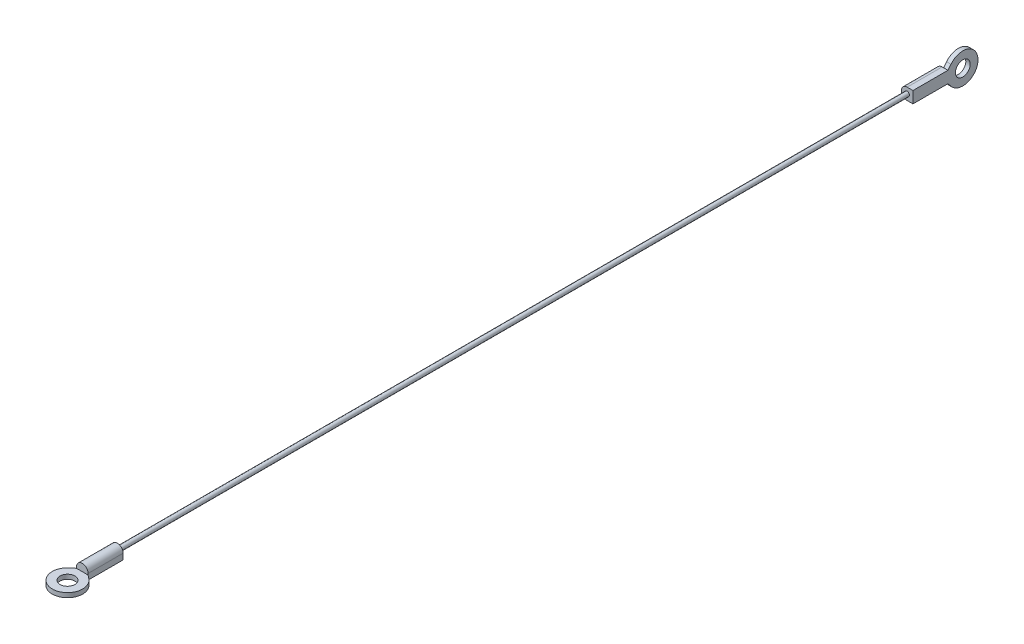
SolidWorks part; units mm, degrees
ref_plane "Front Plane" through (0, 0, 0) normal (0, 0, 1) x (1, 0, 0)
ref_plane "Top Plane" through (0, 0, 0) normal (0, 1, 0) x (1, 0, 0)
ref_plane "Right Plane" through (0, 0, 0) normal (1, 0, 0) x (0, 0, -1)
sketch "Sketch1" plane through (0, 0, 0) normal (0, 0, 1) x (1, 0, 0)
  circle A0 centre (0, 0) radius 0.795
extrude "Boss-Extrude1" add sketch "Sketch1" along normal mid plane 270.64
sketch "Sketch2" plane through (0, 0, 135.32) normal (0, 0, 1) x (1, 0, 0)
  line L0 (-1.99, 0) -> (-1.99, -1.99)
  line L1 (-1.99, -1.99) -> (0, -1.99)
  line L2 (0, -1.99) -> (1.99, -1.99)
  line L3 (1.99, -1.99) -> (1.99, 0)
  arc A0 (1.99, 0) -> (-1.99, 0) centre (0, 0) ccw
  dimension "D1" = 3.98
extrude "Boss-Extrude2" add sketch "Sketch2" along normal blind 12
sketch "Sketch3" plane through (0, -1.99, 0) normal (0, -1, 0) x (1, 0, 0)
  line L0 (1.99, 147.32) -> (3.2639, 148.3455)
  line L1 (-3.2639, 148.3455) -> (-1.99, 147.32)
  line L2 (-1.99, 147.32) -> (1.99, 147.32)
  arc A0 (3.2639, 148.3455) -> (-3.2639, 148.3455) centre (0, 152.4) ccw
  circle A1 centre (0, 152.4) radius 2.54
  point P8 (5.205, 152.4)
  point P9 (-5.205, 152.4)
  dimension "D1" = 5.08
  dimension "D2" = 10.41
  dimension "D3" = 152.4
extrude "Boss-Extrude3" add sketch "Sketch3" against normal blind 1.52
sketch "Sketch4" plane through (0, 0, -135.32) normal (0, 0, -1) x (-1, 0, 0)
  line L0 (0, 1.99) -> (-1.99, 1.99)
  line L1 (-1.99, 1.99) -> (-1.99, 0)
  line L2 (-1.99, 0) -> (-1.99, -1.99)
  line L3 (-1.99, -1.99) -> (0, -1.99)
  arc A0 (0, -1.99) -> (0, 1.99) centre (0, 0) ccw
  dimension "D1" = 3.98
extrude "Boss-Extrude4" add sketch "Sketch4" along normal blind 12
sketch "Sketch5" plane through (1.99, 0, 0) normal (1, 0, 0) x (0, 0, -1)
  line L0 (147.32, -1.99) -> (147.32, 1.99)
  line L1 (147.32, 1.99) -> (148.3455, 3.2639)
  line L2 (148.3455, -3.2639) -> (147.32, -1.99)
  arc A0 (148.3455, 3.2639) -> (148.3455, -3.2639) centre (152.4, 0) cw
  circle A1 centre (152.4, 0) radius 2.54
  point P8 (152.4, 5.205)
  point P9 (152.4, -5.205)
  dimension "D1" = 5.08
  dimension "D2" = 10.41
  dimension "D3" = 152.4
extrude "Boss-Extrude5" add sketch "Sketch5" against normal blind 1.52
